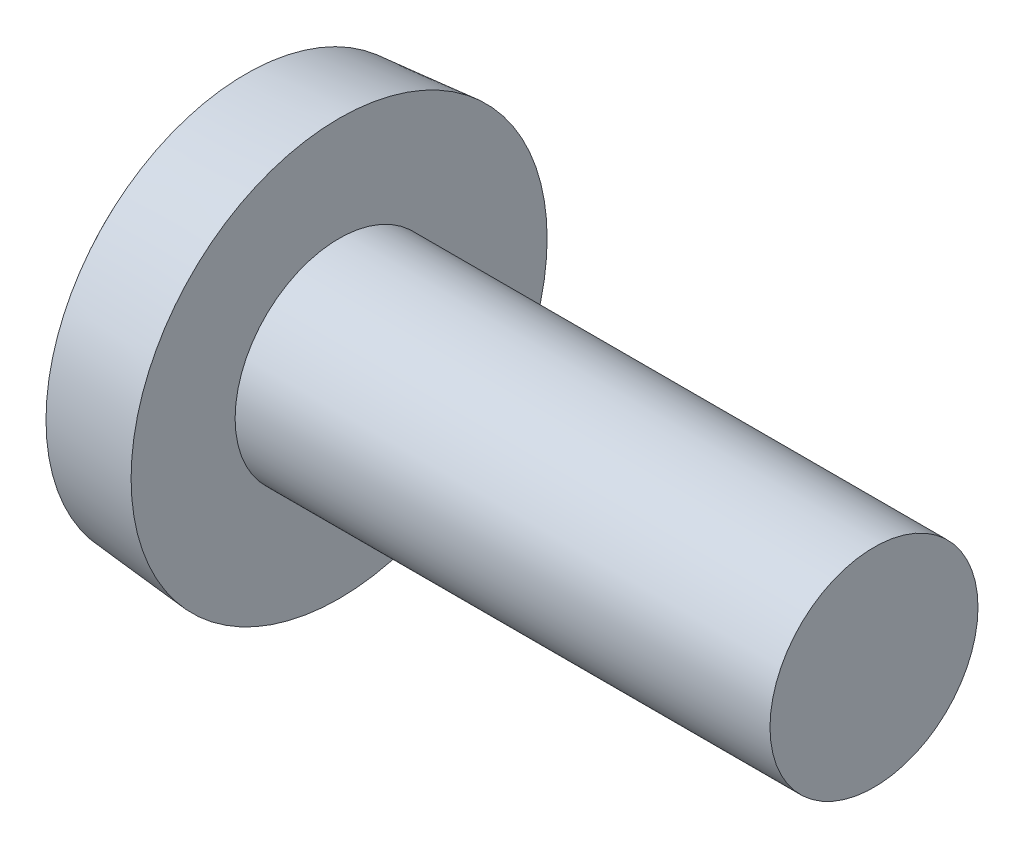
SolidWorks part; units mm, degrees
ref_plane "正面" through (0, 0, 0) normal (0, 0, 1) x (1, 0, 0)
ref_plane "平面" through (0, 0, 0) normal (0, 1, 0) x (1, 0, 0)
ref_plane "右側面" through (0, 0, 0) normal (1, 0, 0) x (0, 0, -1)
ref_plane "平面1" through (0, 0, 0) normal (0, 0, -1) x (-1, 0, 0)
sketch "ｽｹｯﾁ1" plane through (0, 0, 0) normal (0, 0, -1) x (-1, 0, 0)
  line L0 (0, 3.5) -> (0, 0)
  line L1 (0, 0) -> (2.7, 0)
  line L2 (1.5691, 3.3627) -> (0, 3.5)
  line L3 (0, 0) -> (2.7, 0) construction
  arc A0 (2.7, 0) -> (1.5691, 3.3627) centre (-2.865, 0) ccw
  point P5 (0, 0)
  point P6 (0, 0)
  point P7 (0.2584, 3.29)
  point P8 (0, 0)
  dimension "D4" = 5.565
  dimension "D1" = 2.7
  dimension "D2" = 3.5
  dimension "D3" = 85
revolve "回転1" add sketch "ｽｹｯﾁ1" angle 360 about L3
sketch "ｽｹｯﾁ2" plane through (0, 0, 0) normal (1, 0, 0) x (0, 0, -1)
  circle A0 centre (0, 0) radius 1.75
  point P2 (0, -0.3718)
  dimension "D1" = 3.5
extrude "ﾎﾞｽ - 押し出し1" add sketch "ｽｹｯﾁ2" along normal blind 9
ref_plane "平面2" through (-0.7, 0, 0) normal (1, 0, 0) x (0, 0, -1)
sketch "ｽｹｯﾁ3" plane through (-0.7, 0, 0) normal (1, 0, 0) x (0, 0, -1)
  line L0 (-2.25, 0.5) -> (-2.25, -0.5)
  line L1 (-2.25, -0.5) -> (-0.5, -0.5)
  line L2 (-0.5, -0.5) -> (-0.5, -2.25)
  line L3 (-0.5, -2.25) -> (0.5, -2.25)
  line L4 (0.5, -2.25) -> (0.5, -0.5)
  line L5 (0.5, -0.5) -> (2.25, -0.5)
  line L6 (2.25, -0.5) -> (2.25, 0.5)
  line L7 (2.25, 0.5) -> (0.5, 0.5)
  line L8 (0.5, 0.5) -> (0.5, 2.25)
  line L9 (0.5, 2.25) -> (-0.5, 2.25)
  line L10 (-0.5, 2.25) -> (-0.5, 0.5)
  line L11 (-0.5, 0.5) -> (-2.25, 0.5)
  point P15 (-7.5364, 2.8551)
  point P16 (-3.7875, 1.6281)
  dimension "D1" = 1
  dimension "D2" = 1.75
  dimension "D3" = 0.5
  dimension "D4" = 0.5
extrude "ｶｯﾄ - 押し出し1" cut sketch "ｽｹｯﾁ3" against normal through all
